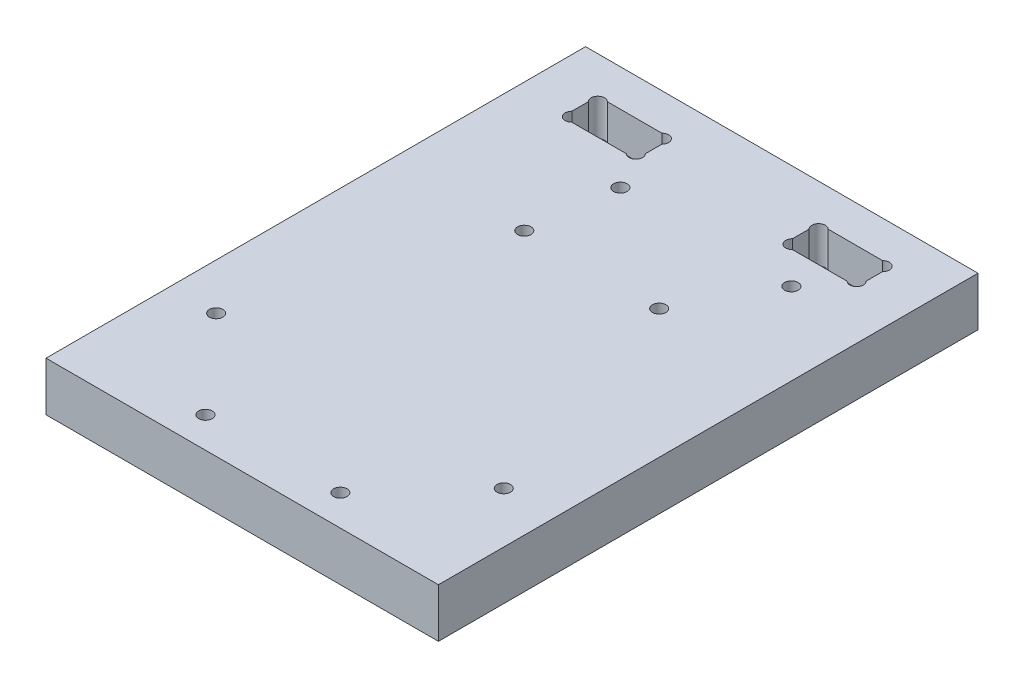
SolidWorks part; units mm, degrees
ref_plane "Plan de face" through (0, 0, 0) normal (0, 0, 1) x (1, 0, 0)
ref_plane "Plan de dessus" through (0, 0, 0) normal (0, 1, 0) x (1, 0, 0)
ref_plane "Plan de droite" through (0, 0, 0) normal (1, 0, 0) x (0, 0, -1)
sketch "Esquisse1" plane through (0, 0, 0) normal (0, 1, 0) x (1, 0, 0)
  line L0 (56.5243, 44) -> (-36.5224, 44) construction
  line L1 (-32, 44) -> (32, 44)
  line L2 (-32, 44) -> (-32, -44)
  line L3 (-32, -44) -> (32, -44)
  line L4 (32, 44) -> (32, -44)
  line L5 (-32, 44) -> (32, -44) construction
  line L6 (-32, -44) -> (32, 44) construction
  line L7 (49.8298, 38) -> (-34.4288, 38) construction
  line L8 (0, -6.0626) -> (0, 35.4598) construction
  line L9 (49.8298, 32.2) -> (0.2895, 32.2) construction
  line L10 (24, 35.4598) -> (24, 33) construction
  line L11 (12, 35.4598) -> (12, 18.5612) construction
  line L12 (8.5, 32.7196) -> (8.5, 16.2263) construction
  line L13 (27.5, 32.7196) -> (27.5, 16.2263) construction
  line L14 (22.2184, 35.1) -> (41.3255, 35.1) construction
  line L15 (18, 29.557) -> (18, 21.7272) construction
  line L16 (24, 32.2) -> (18.9403, 37.2597) construction
  line L17 (12, 36.4444) -> (12, 33.7556)
  line L18 (13.5556, 32.2) -> (22.4444, 32.2)
  line L19 (24, 36.4444) -> (24, 33.7556)
  line L20 (13.5556, 38) -> (22.4444, 38)
  line L21 (-13.5556, 38) -> (-22.4444, 38)
  line L22 (-24, 36.4444) -> (-24, 33.7556)
  line L23 (-13.5556, 32.2) -> (-22.4444, 32.2)
  line L24 (-12, 36.4444) -> (-12, 33.7556)
  line L25 (-14.997, 26.9225) -> (56.5243, 26.9225) construction
  line L26 (43.4174, -23.7872) -> (-36.5224, -23.7872) construction
  line L27 (56.5243, -25.055) -> (18.2218, -25.055) construction
  line L28 (23.7096, -50.0294) -> (23.7096, -20.209) construction
  line L29 (-24.4645, -50.0294) -> (-24.4645, -20.209) construction
  line L30 (-9.2517, 47.8737) -> (-9.2517, 23.8496) construction
  line L31 (18.6385, 23.8496) -> (18.6385, 47.8737) construction
  line L32 (-11, -4.899) -> (-11, -46.6425) construction
  line L33 (-17.835, -39) -> (20.3271, -39) construction
  line L34 (-17.835, -13) -> (20.3271, -13) construction
  arc A0 (22.4444, 32.2) -> (24, 33.7556) centre (23.2222, 32.9778) ccw
  arc A1 (22.4444, 38) -> (24, 36.4444) centre (23.2222, 37.2222) cw
  arc A2 (13.5556, 38) -> (12, 36.4444) centre (12.7778, 37.2222) ccw
  arc A3 (13.5556, 32.2) -> (12, 33.7556) centre (12.7778, 32.9778) cw
  arc A4 (-22.4444, 38) -> (-24, 36.4444) centre (-23.2222, 37.2222) ccw
  arc A5 (-22.4444, 32.2) -> (-24, 33.7556) centre (-23.2222, 32.9778) cw
  arc A6 (-13.5556, 32.2) -> (-12, 33.7556) centre (-12.7778, 32.9778) ccw
  arc A7 (-13.5556, 38) -> (-12, 36.4444) centre (-12.7778, 37.2222) cw
  circle A8 centre (-24.4645, -23.7872) radius 1.1
  circle A9 centre (-9.2517, 26.9225) radius 1.1
  circle A10 centre (18.6385, 26.9225) radius 1.1
  circle A11 centre (23.7096, -25.055) radius 1.1
  circle A12 centre (-11, -39) radius 1.1
  circle A13 centre (11, -39) radius 1.1
  circle A14 centre (11, 13) radius 1.1
  circle A15 centre (-11, 13) radius 1.1
  point P0 (0, 0)
  dimension "D10" = 13.3615
  dimension "D1" = 6
  dimension "D2" = 5.8
  dimension "D3" = 12
  dimension "D4" = 12
  dimension "D5" = 19
  dimension "D6" = 3.5
  dimension "D7" = 45
  dimension "D8" = 2.9
  dimension "D9" = 6
  dimension "D11" = 27.8902
  dimension "D12" = 50.7097
  dimension "D13" = 17.0775
  dimension "D14" = 51.9775
  dimension "D15" = 8.2904
  dimension "D16" = 48.174
  dimension "D17" = 11
  dimension "D18" = 26
  dimension "D19" = 5
extrude "Boss.-Extru.1" add sketch "Esquisse1" along normal blind 8
sketch "Esquisse2" plane through (0, 0, 0) normal (0, -1, 0) x (1, 0, 0)
  line L0 (0, -35.6343) -> (0, 0) construction
  line L1 (-20.2378, -35.1) -> (-12, -35.1) construction
  line L2 (-18, -32.2) -> (-18, -24.5558) construction
  line L3 (-22.4444, -32.2) -> (-13.5556, -32.2) construction
  line L4 (-27, -29.6) -> (-9, -29.6)
  line L5 (-27, -29.6) -> (-27, -40.6)
  line L6 (-27, -40.6) -> (-9, -40.6)
  line L7 (-9, -29.6) -> (-9, -40.6)
  line L8 (-27, -29.6) -> (-9, -40.6) construction
  line L9 (-27, -40.6) -> (-9, -29.6) construction
  line L10 (-12, -33.7556) -> (-12, -36.4444) construction
  line L11 (9, -29.6) -> (9, -40.6)
  line L12 (27, -40.6) -> (9, -40.6)
  line L13 (27, -29.6) -> (27, -40.6)
  line L14 (27, -29.6) -> (9, -29.6)
  point P6 (-18, -35.1)
extrude "Enlèv. mat.-Extru.1" cut sketch "Esquisse2" against normal blind 2
